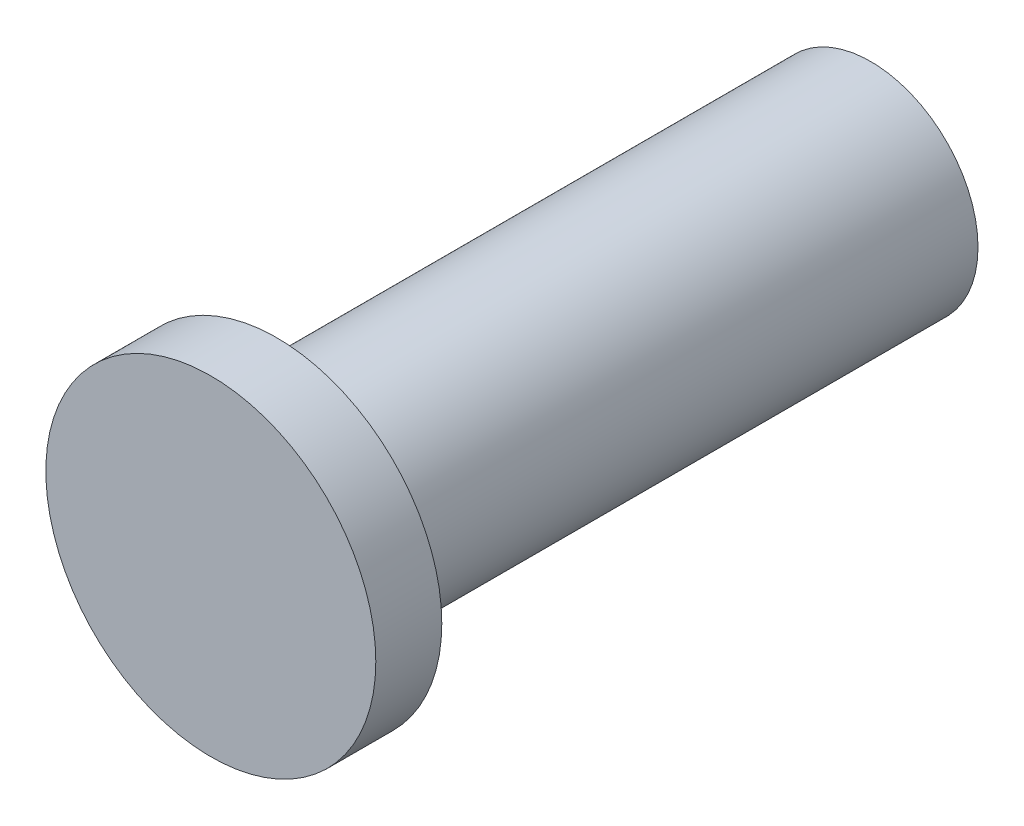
SolidWorks part; units mm, degrees
ref_plane "Front Plane" through (0, 0, 0) normal (0, 0, 1) x (1, 0, 0)
ref_plane "Top Plane" through (0, 0, 0) normal (0, 1, 0) x (1, 0, 0)
ref_plane "Right Plane" through (0, 0, 0) normal (1, 0, 0) x (0, 0, -1)
sketch "Sketch1" plane through (0, 0, 0) normal (0, 0, 1) x (1, 0, 0)
  circle A0 centre (0, 0) radius 3.25
  dimension "D1" = 6.5
extrude "Boss-Extrude1" add sketch "Sketch1" along normal blind 20
sketch "Sketch2" plane through (0, 0, 20) normal (0, 0, 1) x (1, 0, 0)
  circle A0 centre (0, 0) radius 5
  dimension "D1" = 10
extrude "Boss-Extrude2" add sketch "Sketch2" against normal blind 2
